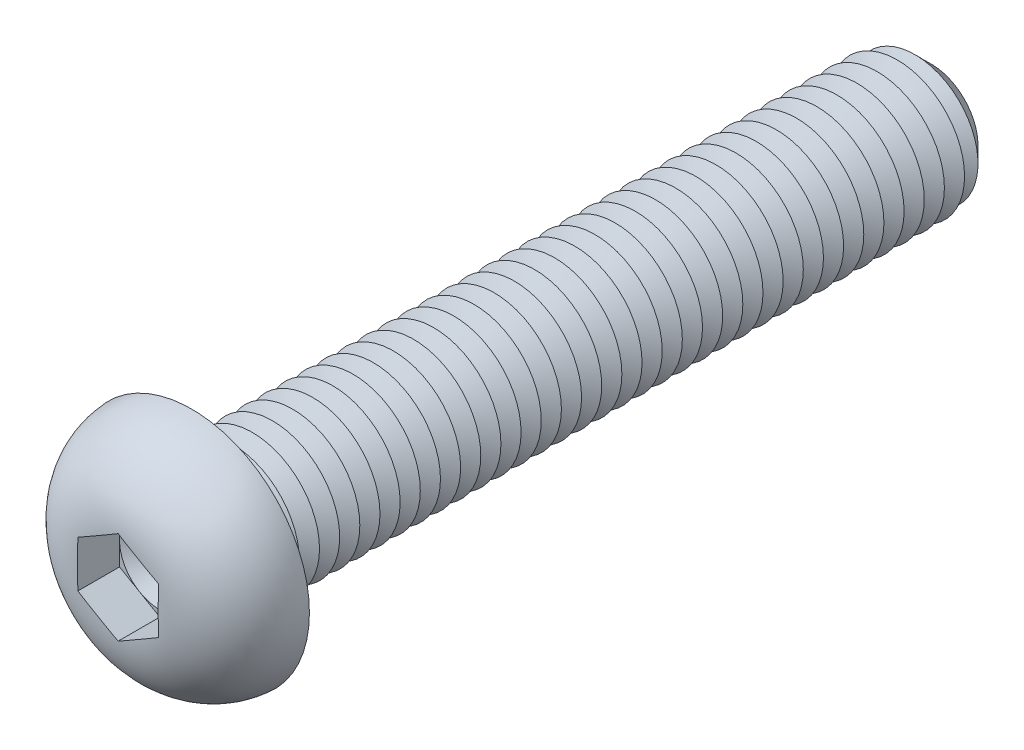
SolidWorks part; units mm, degrees
ref_plane "Front Plane" through (0, 0, 0) normal (0, 0, 1) x (1, 0, 0)
ref_plane "Top Plane" through (0, 0, 0) normal (0, 1, 0) x (1, 0, 0)
ref_plane "Right Plane" through (0, 0, 0) normal (1, 0, 0) x (0, 0, -1)
sketch "Sketch1" plane through (0, 0, 0) normal (1, 0, 0) x (0, 0, -1)
  line L0 (-47.9342, 0) -> (60.3146, 0) construction
sketch "Sketch2" plane through (0, 0, 0) normal (1, 0, 0) x (0, 0, -1)
  line L0 (0, 0) -> (-5.5, 0)
  line L1 (-47.9342, 0) -> (60.3146, 0) construction
  line L2 (-5.5, 0) -> (-5.5, 2.9578)
  line L3 (0, 8.75) -> (0, 0)
  arc A0 (-5.5, 2.9578) -> (0, 8.75) centre (0.3, 2.9578) cw
  dimension "D1" = 5.8
  dimension "D2" = 5.5
  dimension "D3" = 8.75
revolve "Revolve1" add sketch "Sketch2" angle 360 about L0
sketch "Sketch3" plane through (0, 0, 5.5) normal (0, 0, 1) x (1, 0, 0)
  line L1 (0, 3.4641) -> (-3, 1.7321)
  line L2 (-3, 1.7321) -> (-3, -1.7321)
  line L3 (-3, -1.7321) -> (0, -3.4641)
  line L4 (0, -3.4641) -> (3, -1.7321)
  line L5 (3, -1.7321) -> (3, 1.7321)
  line L6 (3, 1.7321) -> (0, 3.4641)
  circle A0 centre (0, 0) radius 3 construction
  dimension "D1" = 6
extrude "Cut-Extrude1" cut sketch "Sketch3" against normal blind 3.12
sketch "Sketch4" plane through (0, 0, 0) normal (0, 0, -1) x (-1, 0, 0)
  circle A0 centre (0, 0) radius 5
  dimension "D1" = 10
extrude "Boss-Extrude1" add sketch "Sketch4" along normal blind 55
chamfer "Chamfer1" distance 1.5 angle 45 1 edges at (-5, 0, -55)
sketch "Sketch5" plane through (0, 0, 0) normal (1, 0, 0) x (0, 0, -1)
  line L0 (1.5, 5) -> (3, 5)
  line L1 (53.5, 5) -> (0, 5) construction
  line L2 (3, 5) -> (2.25, 3.701)
  line L3 (2.25, 3.701) -> (1.5, 5)
  line L4 (0, -8.75) -> (0, 8.75) construction
  line L5 (53.5, 5) -> (0, 5) construction
  dimension "D1" = 1.5
  dimension "D2" = 1.5
revolve "Cut-Revolve1" cut sketch "Sketch5" angle 360 about L0
pattern_linear "LPattern1" count 35 spacing 1.5 along (0, 0, -1) of "Cut-Revolve1"
fillet "Fillet2" radius 0.6 1 edges at (5, 0, 0)
sketch "Sketch6" plane through (0, 0, 2.38) normal (0, 0, 1) x (1, 0, 0)
  line L0 (0, -3.4641) -> (3, -1.7321) construction
  circle A0 centre (0, 0) radius 3
extrude "Cut-Extrude2" cut sketch "Sketch6" against normal through all draft 60
